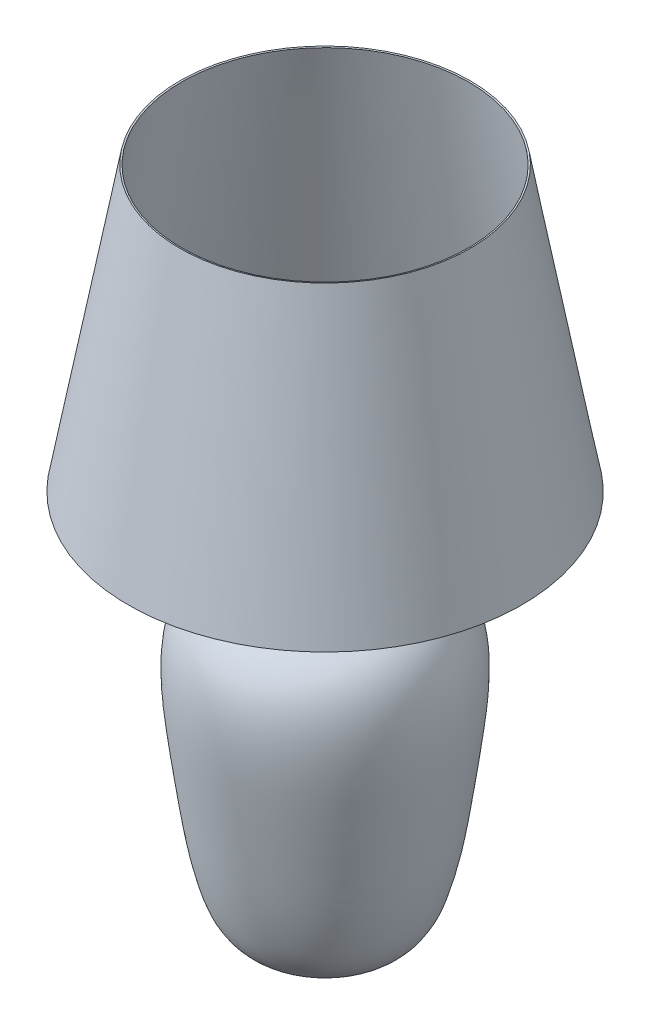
SolidWorks part; units mm, degrees
ref_plane "Płaszczyzna przednia" through (0, 0, 0) normal (0, 0, 1) x (1, 0, 0)
ref_plane "Płaszczyzna górna" through (0, 0, 0) normal (0, 1, 0) x (1, 0, 0)
ref_plane "Płaszczyzna prawa" through (0, 0, 0) normal (1, 0, 0) x (0, 0, -1)
sketch "Szkic1" plane through (0, 0, 0) normal (0, 0, 1) x (1, 0, 0)
  line L0 (584, 1168) -> (2920, 1168) construction
  line L1 (1705.051, 405.2076) -> (1816.9464, 405.2076)
  line L2 (1736.6285, 1022.0462) -> (1791.552, 1022.0462)
  line L3 (1791.552, 1022.0462) -> (1791.552, 1107.9599)
  line L4 (1791.552, 1107.9599) -> (1451.8928, 1107.9599)
  line L5 (1451.8928, 1107.9599) -> (1547.4812, 1633.358)
  line L6 (1816.9464, 405.2076) -> (1816.9464, 1370.6589) construction
  spline S0 degree 3 poles (1705.051, 405.2076) (1672.6157, 425.1354) (1641.8739, 499.5808) (1624.1587, 616.112) (1603.3585, 764.9901) (1586.0582, 938.945) (1693.6046, 978.4427) (1730.9458, 991.929) (1737.9694, 1002.3476) (1736.6285, 1022.0462) knots 0 0 0 0 0.142045 0.354962 0.496006 0.825229 0.934116 0.951593 1 1 1 1
revolve "Obrót-cienka ścianka1" add sketch "Szkic1" angle 360 about L6
